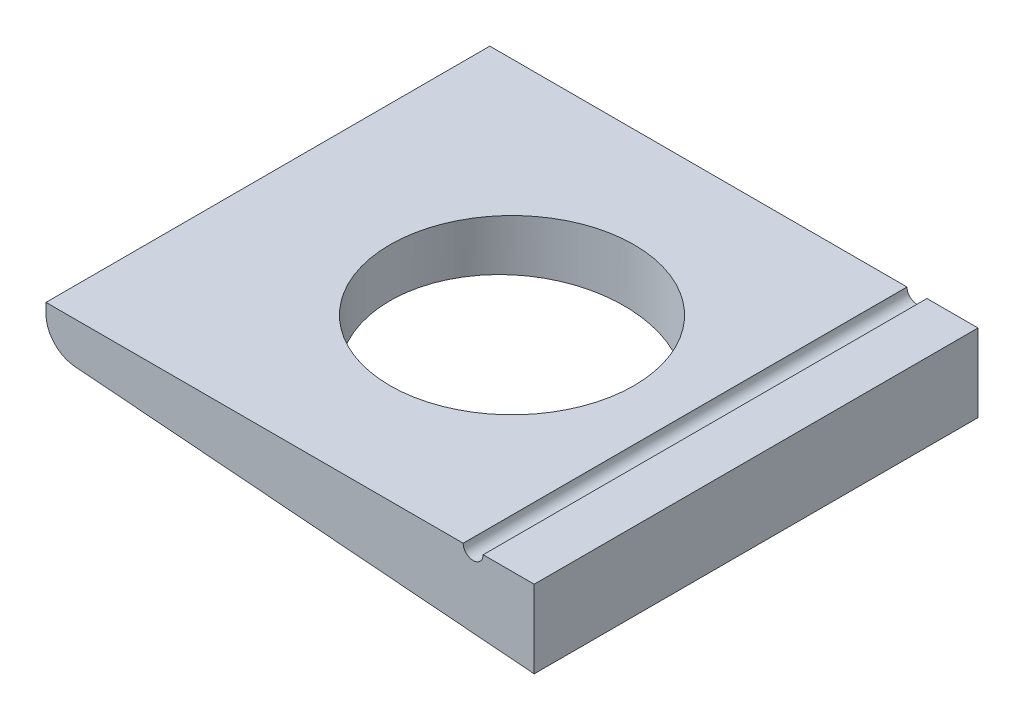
SolidWorks part; units mm, degrees
ref_plane "Plane1" through (0, 0, 0) normal (0, 0, 1) x (1, 0, 0)
ref_plane "Plane2" through (0, 0, 0) normal (0, 1, 0) x (1, 0, 0)
ref_plane "Plane3" through (0, 0, 0) normal (1, 0, 0) x (0, 0, -1)
sketch "Sketch1" plane through (0, 0, 0) normal (0, 0, 1) x (1, 0, 0)
  line L0 (22, 0) -> (-22, 0)
  line L1 (22, 0) -> (22, -7)
  line L2 (-22, 0) -> (-22, -0.9139)
  line L3 (22, -7) -> (-19.422, -3.7051)
  line L4 (0, 0) -> (0, -5.25) construction
  arc A0 (-19.422, -3.7051) -> (-22, -0.9139) centre (-19.2, -0.9139) cw
  dimension "R" = 2.8
  dimension "B" = 44
  dimension "D2" = 22
  dimension "H" = 7
  dimension "E" = 5.25
extrude "Base-Extrude" add sketch "Sketch1" along normal mid plane 40
sketch "Sketch2" plane through (0, 0, 0) normal (0, 1, 0) x (-1, 0, 0)
  circle A0 centre (0, 0) radius 11
  dimension "D" = 22
extrude "Cut-Extrude1" cut sketch "Sketch2" against normal through all
sketch "Sketch3" plane through (0, 0, 20) normal (0, 0, 1) x (1, 0, 0)
  line L0 (22, 0) -> (-22, 0) construction
  circle A0 centre (16.5, 0) radius 0.9
  dimension "T" = 0.9
  dimension "D2" = 16.5
extrude "ID-Grooves" cut sketch "Sketch3" against normal through all
equation "\"D2@Sketch1\" = \"B@Sketch1\" / 2"
equation "\"D2@Sketch3\" =  ( \"D@Sketch2\" / 2 )  +  ( \"B@Sketch1\" -  \"D@Sketch2\" )  / 4"
